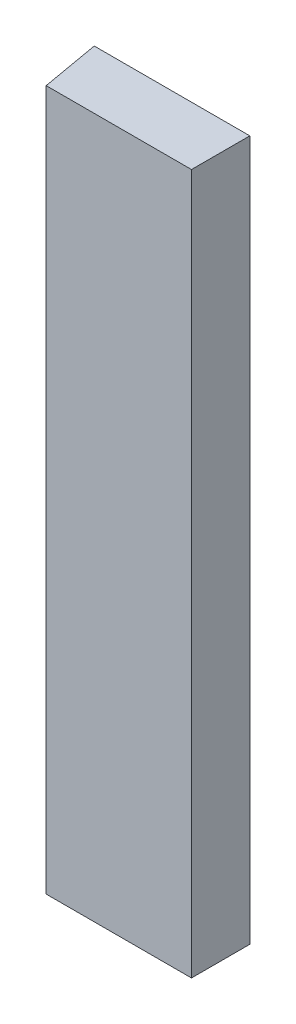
SolidWorks part; units mm, degrees
ref_plane "Front Plane" through (0, 0, 0) normal (0, 0, 1) x (1, 0, 0)
ref_plane "Top Plane" through (0, 0, 0) normal (0, 1, 0) x (1, 0, 0)
ref_plane "Right Plane" through (0, 0, 0) normal (1, 0, 0) x (0, 0, -1)
sketch "Sketch1" plane through (0, 0, 0) normal (0, 1, 0) x (1, 0, 0)
  line L1 (-17.5394, 0) -> (84.0606, 0)
  line L2 (-17.5394, 0) -> (-17.5394, -38.1)
  line L3 (-17.5394, -38.1) -> (84.0606, -38.1)
  line L4 (84.0606, 0) -> (84.0606, -38.1)
  dimension "D1" = 101.6
  dimension "D2" = 38.1
extrude "Boss-Extrude1" add sketch "Sketch1" along normal blind 457.2
sketch "Sketch2" plane through (0, 457.2, 0) normal (0, 1, 0) x (1, 0, 0)
  line L0 (-17.5394, 0) -> (-10.8213, -38.1)
  line L1 (-17.5394, -38.1) -> (84.0606, -38.1) construction
  line L2 (-10.8213, -38.1) -> (-17.5394, -38.1)
  line L3 (-17.5394, -38.1) -> (-17.5394, 0)
  dimension "D1" = 10
extrude "Cut-Extrude1" cut sketch "Sketch2" against normal through all
